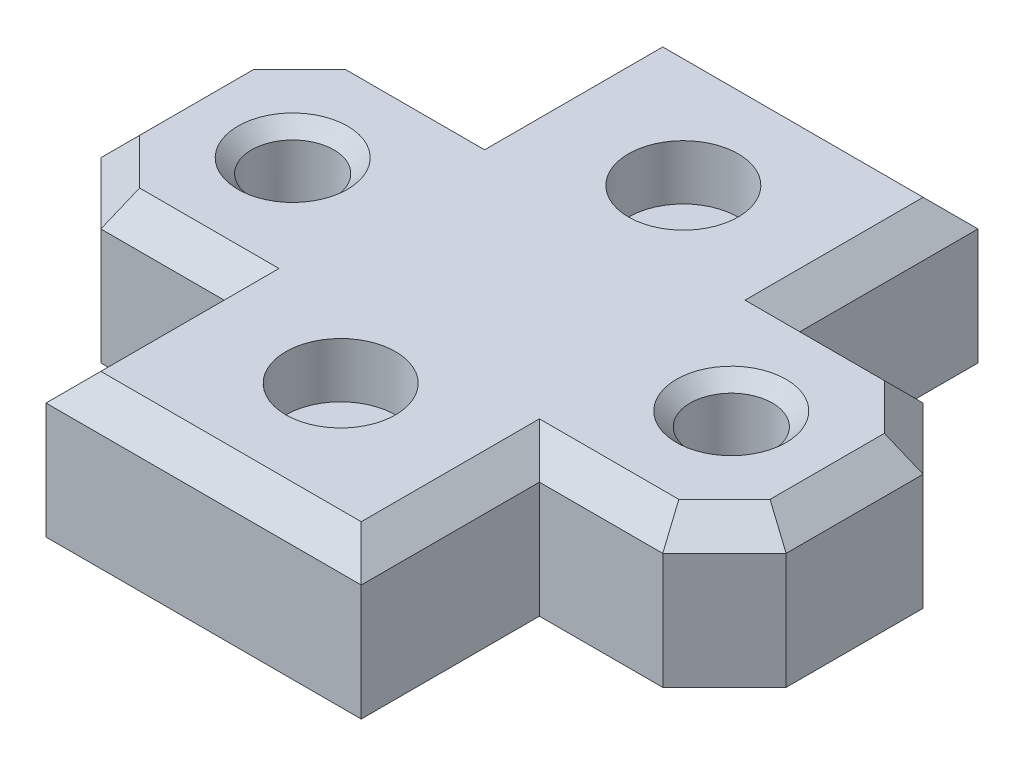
SolidWorks part; units mm, degrees
ref_plane "Vorne" through (0, 0, 0) normal (0, 0, 1) x (1, 0, 0)
ref_plane "Oben" through (0, 0, 0) normal (0, 1, 0) x (1, 0, 0)
ref_plane "Rechts" through (0, 0, 0) normal (1, 0, 0) x (0, 0, -1)
sketch "Skizze1" plane through (0, 0, 0) normal (0, 1, 0) x (1, 0, 0)
  line L0 (0, 81.9687) -> (0, -64.4353) construction
  line L1 (11.5, 22.5) -> (-11.5, 22.5)
  line L2 (-11.5, 22.5) -> (-11.5, 9.5)
  line L3 (11.5, 22.5) -> (11.5, 9.5)
  line L4 (-11.5, 9.5) -> (-20.5, 9.5)
  line L5 (11.5, 9.5) -> (20.5, 9.5)
  line L6 (-20.5, 9.5) -> (-25, 5)
  line L7 (20.5, 9.5) -> (25, 5)
  line L8 (-25, 5) -> (-25, -5)
  line L9 (25, 5) -> (25, -5)
  line L10 (-25, -5) -> (-20.5, -9.5)
  line L11 (25, -5) -> (20.5, -9.5)
  line L12 (-20.5, -9.5) -> (-11.5, -9.5)
  line L13 (20.5, -9.5) -> (11.5, -9.5)
  line L14 (-11.5, -9.5) -> (-11.5, -22.5)
  line L15 (11.5, -9.5) -> (11.5, -22.5)
  line L16 (-11.5, -22.5) -> (11.5, -22.5)
  point P6 (0, 22.5)
  point P20 (0, -22.5)
  dimension "D1" = 23
  dimension "D2" = 19
  dimension "D3" = 10
  dimension "D4" = 45
  dimension "D5" = 45
  dimension "D6" = 4.5
  dimension "D7" = 50
  dimension "D8" = 23
  dimension "D9" = 45
  dimension "D10" = 22.5
  dimension "D11" = 13
extrude "Linear austragen1" add sketch "Skizze1" along normal blind 10.47
chamfer "Fase1" distance 2 angle 45 16 edges at (22.75, 10.47, -7.25) (25, 10.47, 0) (22.75, 10.47, 7.25) (16, 10.47, 9.5) (11.5, 10.47, 16) (0, 10.47, 22.5) (-11.5, 10.47, 16) (-16, 10.47, 9.5) (-22.75, 10.47, 7.25) (-25, 10.47, 0) (-22.75, 10.47, -7.25) (-16, 10.47, -9.5) (-11.5, 10.47, -16) (0, 10.47, -22.5) (11.5, 10.47, -16) (16, 10.47, -9.5)
sketch "Skizze2" plane through (0, 10.47, 0) normal (0, 1, 0) x (1, 0, 0)
  circle A0 centre (16, 0) radius 3
  circle A1 centre (-16, 0) radius 3
  dimension "D1" = 6
  dimension "D2" = 6
  dimension "D3" = 32
  dimension "D4" = 16
extrude "Linear austragen2" cut sketch "Skizze2" against normal through all
chamfer "Fase2" distance 1 angle 45 2 edges at (16, 10.47, 3) (-16, 10.47, 3)
sketch "Skizze3" plane through (0, 10.47, 0) normal (0, 1, 0) x (1, 0, 0)
  line L0 (11.5, -22.5) -> (-11.5, -22.5) construction
  circle A0 centre (0, -12.5) radius 4
  circle A1 centre (0, 12.5) radius 4
  point P4 (0, -22.5)
  dimension "D1" = 8
  dimension "D2" = 8
  dimension "D3" = 25
  dimension "D4" = 10
extrude "Linear austragen3" cut sketch "Skizze3" against normal blind 4
